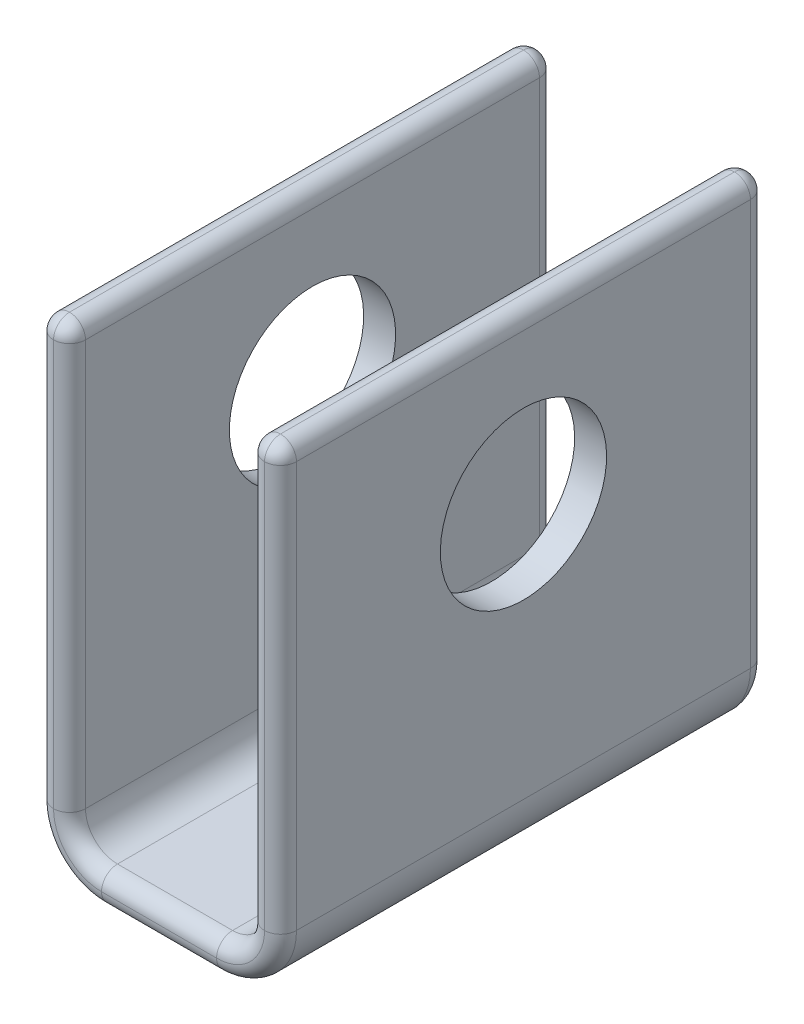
SolidWorks part; units mm, degrees
ref_plane "Front Plane" through (0, 0, 0) normal (0, 0, 1) x (1, 0, 0)
ref_plane "Top Plane" through (0, 0, 0) normal (0, 1, 0) x (1, 0, 0)
ref_plane "Right Plane" through (0, 0, 0) normal (1, 0, 0) x (0, 0, -1)
sketch "Sketch1" plane through (0, 0, 0) normal (0, 0, 1) x (1, 0, 0)
  line L0 (-4.5, 0) -> (4.5, 0)
  line L1 (-9.5, 5) -> (-9.5, 38)
  line L2 (9.5, 5) -> (9.5, 38)
  arc A0 (4.5, 0) -> (9.5, 5) centre (4.5, 5) ccw
  arc A1 (-4.5, 0) -> (-9.5, 5) centre (-4.5, 5) cw
  point P4 (0, 0)
  point P9 (9.5, 0)
  point P12 (-9.5, 0)
  dimension "D3" = 5
  dimension "D1" = 19
  dimension "D2" = 38
extrude "Extrude-Thin1" add sketch "Sketch1" along normal mid plane 38 thin
fillet "Fillet9" radius 1.25 24 edges at (9.5, 21.5, 19) (9.5, 38, 0) (9.5, 21.5, -19) (-7, 21.5, -19) (-9.5, 21.5, -19) (-8.0355, 1.4645, -19) (0, 0, -19) (8.0355, 1.4645, -19) (7, 21.5, -19) (6.2678, 3.2322, -19) (0, 2.5, -19) (-6.2678, 3.2322, -19) (-7, 21.5, 19) (-9.5, 21.5, 19) (-8.0355, 1.4645, 19) (0, 0, 19) (8.0355, 1.4645, 19) (7, 21.5, 19) (6.2678, 3.2322, 19) (-6.2678, 3.2322, 19) (7, 38, 0) (-9.5, 38, 0) (-7, 38, 0) (0, 2.5, 19)
sketch "Sketch2" plane through (9.5, 0, 0) normal (1, 0, 0) x (0, 0, -1)
  line L0 (0, 0) -> (0, 25) construction
  line L1 (-17.75, 0) -> (17.75, 0) construction
  line L2 (17.75, 38) -> (-17.75, 38) construction
  circle A0 centre (0, 25) radius 6.5
  dimension "D2" = 13
  dimension "D1" = 13
extrude "Cut-Extrude1" cut sketch "Sketch2" against normal through all
